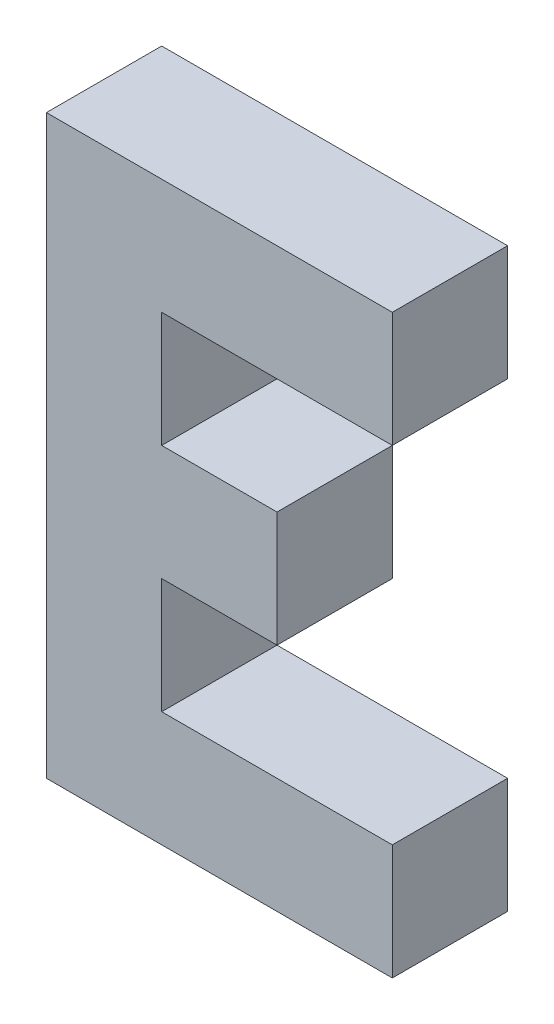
SolidWorks part; units mm, degrees
ref_plane "Plan de face" through (0, 0, 0) normal (0, 0, 1) x (1, 0, 0)
ref_plane "Plan de dessus" through (0, 0, 0) normal (0, 1, 0) x (1, 0, 0)
ref_plane "Plan de droite" through (0, 0, 0) normal (1, 0, 0) x (0, 0, -1)
sketch "Esquisse1" plane through (0, 0, 0) normal (0, 0, 1) x (1, 0, 0)
  line L0 (30, 40) -> (30, 50)
  line L1 (0, 0) -> (30, 0)
  line L2 (0, 0) -> (0, 50)
  line L3 (0, 50) -> (30, 50)
  line L4 (30, 0) -> (30, 10)
  line L5 (30, 40) -> (10, 40)
  line L7 (20, 30) -> (10, 30)
  line L8 (10, 40) -> (10, 30)
  line L9 (20, 20) -> (10, 20)
  line L10 (20, 30) -> (20, 20)
  line L11 (30, 10) -> (10, 10)
  line L12 (10, 20) -> (10, 10)
  dimension "D1" = 10
  dimension "D2" = 10
  dimension "D3" = 10
  dimension "D4" = 10
  dimension "D5" = 10
  dimension "D6" = 30
  dimension "D7" = 20
  dimension "D8" = 20
  dimension "D9" = 10
extrude "Boss.-Extru.1" add sketch "Esquisse1" along normal blind 10
